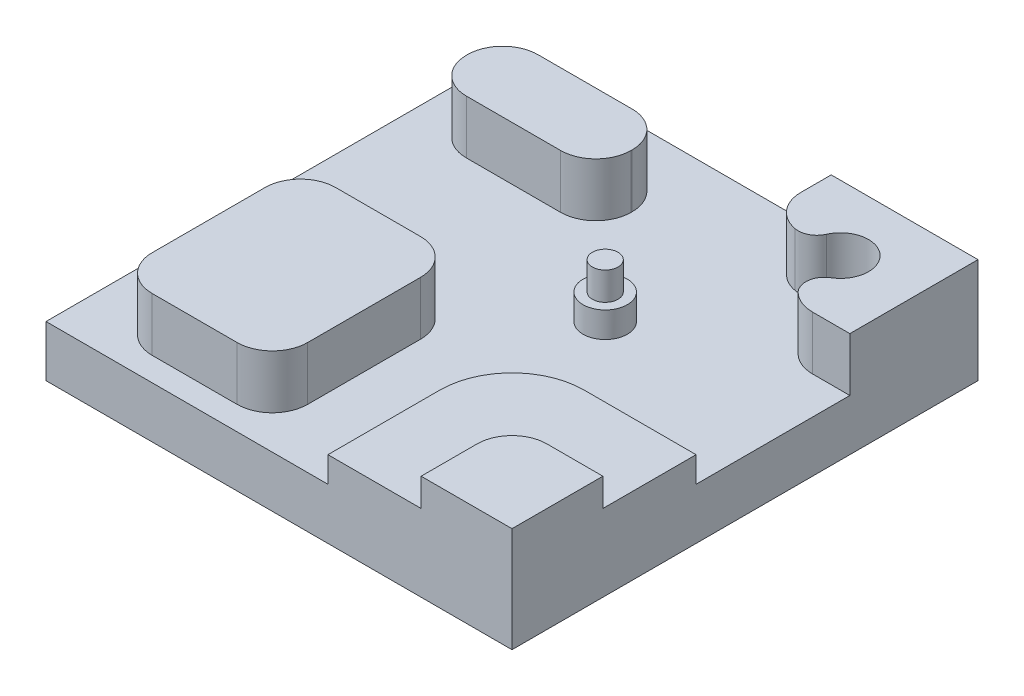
SolidWorks part; units mm, degrees
ref_plane "Front Plane" through (0, 0, 0) normal (0, 0, 1) x (1, 0, 0)
ref_plane "Top Plane" through (0, 0, 0) normal (0, 1, 0) x (1, 0, 0)
ref_plane "Right Plane" through (0, 0, 0) normal (1, 0, 0) x (0, 0, -1)
sketch "Sketch1" plane through (0, 0, 0) normal (0, 1, 0) x (1, 0, 0)
  line L1 (25, -25) -> (-25, -25)
  line L2 (25, -25) -> (25, 25)
  line L3 (25, 25) -> (-25, 25)
  line L4 (-25, -25) -> (-25, 25)
  line L5 (25, -25) -> (-25, 25) construction
  line L6 (25, 25) -> (-25, -25) construction
  point P0 (0, 0)
  dimension "D1" = 50
  dimension "D2" = 50
extrude "Boss-Extrude1" add sketch "Sketch1" along normal blind 5.5 contours L2 L1 L4 L3
sketch "Sketch2" plane through (0, 5.5, 0) normal (0, 1, 0) x (1, 0, 0)
  line L1 (25, -25) -> (15.25, -25)
  line L2 (25, -25) -> (25, -15.25)
  line L3 (25, -15.25) -> (15.25, -15.25)
  line L4 (15.25, -25) -> (15.25, -15.25)
  dimension "D1" = 9.75
  dimension "D2" = 9.75
extrude "Boss-Extrude2" add sketch "Sketch2" along direction (0, -1, 0) on the side of the normal blind 5.75
sketch "Sketch3" plane through (0, 5.5, 0) normal (0, 1, 0) x (1, 0, 0)
  line L1 (25, -25) -> (5.25, -25)
  line L2 (25, -25) -> (25, -5.25)
  line L3 (25, -5.25) -> (5.25, -5.25)
  line L4 (5.25, -25) -> (5.25, -5.25)
  dimension "D1" = 19.75
  dimension "20" = 19.75
extrude "Boss-Extrude3" add sketch "Sketch3" along normal blind 2.75
fillet "Fillet1" radius 3.75 1 edges at (15.25, 9.75, 15.25)
sketch "Sketch4" plane through (0, 5.5, 0) normal (0, 1, 0) x (1, 0, 0)
  line L1 (25, 25) -> (9.25, 25)
  line L2 (25, 25) -> (25, 18)
  line L3 (25, 18) -> (9.25, 18)
  line L4 (9.25, 25) -> (9.25, 18)
  dimension "D1" = 15.75
  dimension "D2" = 7
extrude "Boss-Extrude4" add sketch "Sketch4" along normal blind 5.75
sketch "Sketch5" plane through (0, 5.5, 0) normal (0, 1, 0) x (1, 0, 0)
  line L1 (25, 18) -> (17.25, 18)
  line L2 (25, 18) -> (25, 11.25)
  line L3 (25, 11.25) -> (17.25, 11.25)
  line L4 (17.25, 18) -> (17.25, 11.25)
  dimension "D1" = 7.75
  dimension "D2" = 6.75
extrude "Boss-Extrude5" add sketch "Sketch5" along normal blind 5.75
fillet "Fillet2" radius 3.75 2 edges at (17.25, 8.375, -11.25) (9.25, 8.375, -18)
sketch "Sketch6" plane through (0, 5.5, 0) normal (0, 1, 0) x (1, 0, 0)
  line L0 (-25, -25) -> (-25, 25) construction
  line L1 (-19.95, -22.45) -> (-3.26, -22.45)
  line L2 (-19.95, -22.45) -> (-19.95, -2.76)
  line L3 (-19.95, -2.76) -> (-3.26, -2.76)
  line L4 (-3.26, -22.45) -> (-3.26, -2.76)
  line L5 (5.25, -25) -> (-25, -25) construction
  point P4 (-19.95, -12.605)
  dimension "D1" = 19.69
  dimension "D2" = 16.69
  dimension "D3" = 5.05
  dimension "D4" = 2.55
extrude "Boss-Extrude6" add sketch "Sketch6" along normal blind 5.75
fillet "Fillet3" radius 3.79 4 edges at (-3.26, 8.375, 2.76) (-19.95, 8.375, 2.76) (-3.26, 8.375, 22.45) (-19.95, 8.375, 22.45)
sketch "Sketch7" plane through (0, 5.5, 0) normal (0, 1, 0) x (1, 0, 0)
  line L0 (9.25, 25) -> (-25, 25) construction
  line L1 (-21.44, 20.44) -> (-3.75, 20.44)
  line L2 (-21.44, 20.44) -> (-21.44, 12.75)
  line L3 (-21.44, 12.75) -> (-3.75, 12.75)
  line L4 (-3.75, 20.44) -> (-3.75, 12.75)
  line L5 (-25, -25) -> (-25, 25) construction
  dimension "D1" = 17.69
  dimension "D2" = 7.69
  dimension "D3" = 4.56
  dimension "D4" = 3.56
extrude "Boss-Extrude7" add sketch "Sketch7" along normal blind 5.75
fillet "Fillet4" radius 3.79 4 edges at (-3.75, 8.375, -12.75) (-21.44, 8.375, -12.75) (-3.75, 8.375, -20.44) (-21.44, 8.375, -20.44)
sketch "Sketch8" plane through (0, 5.5, 0) normal (0, 1, 0) x (1, 0, 0)
  line L0 (5.25, -25) -> (15.25, -25) construction
  line L2 (25, -5.25) -> (25, 11.25) construction
  circle A0 centre (5, 5) radius 2.375
  dimension "D1" = 30
  dimension "D2" = 20
extrude "Boss-Extrude8" add sketch "Sketch8" along normal blind 2.75
sketch "Sketch9" plane through (0, 5.5, 0) normal (0, 1, 0) x (1, 0, 0)
  circle A0 centre (5, 5) radius 1.375
extrude "Boss-Extrude9" add sketch "Sketch9" along normal blind 5.75
fillet "Fillet5" radius 7.75 1 edges at (5.25, 6.875, 5.25)
sketch "Sketch10" plane through (0, 11.25, 0) normal (0, 1, 0) x (1, 0, 0)
  circle A0 centre (17.25, 18) radius 3
extrude "Cut-Extrude2" cut sketch "Sketch10" against normal blind 5.75
fillet "Fillet7" radius 2 2 edges at (17.25, 8.375, -15) (14.25, 8.375, -18)
